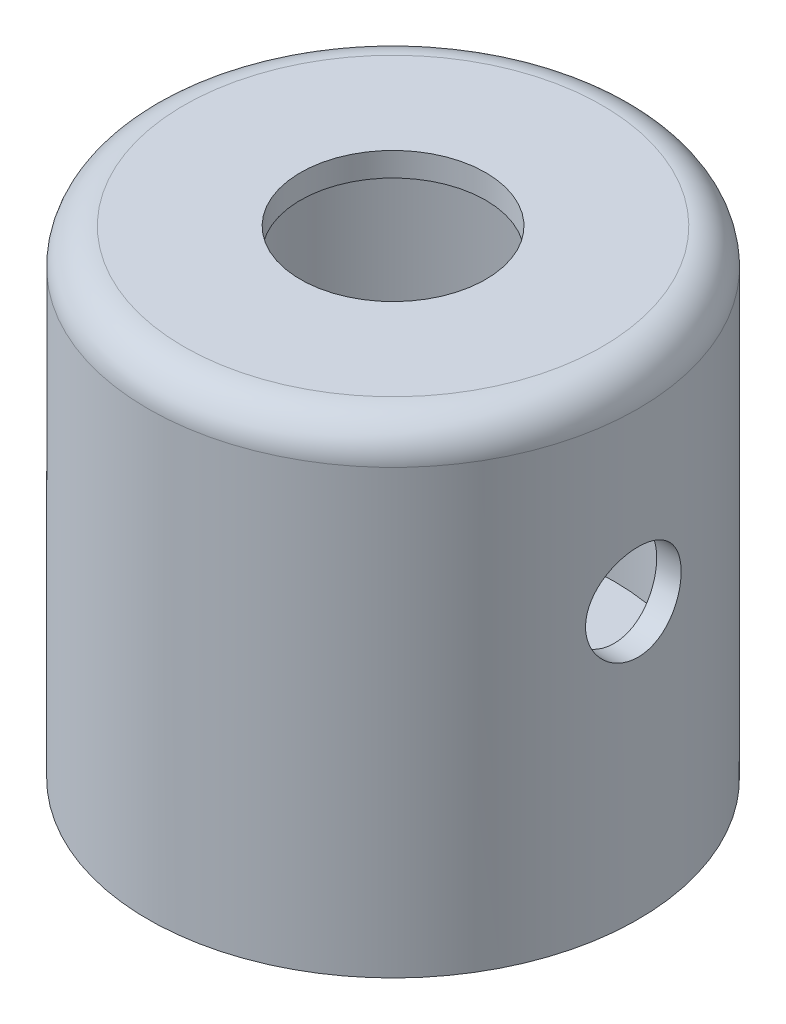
SolidWorks part; units mm, degrees
ref_plane "face" through (0, 0, 0) normal (0, 0, 1) x (1, 0, 0)
ref_plane "dessus" through (0, 0, 0) normal (0, 1, 0) x (1, 0, 0)
ref_plane "profil" through (0, 0, 0) normal (1, 0, 0) x (0, 0, -1)
sketch "Esquisse1" plane through (0, 0, 0) normal (0, 0, 1) x (1, 0, 0)
  line L0 (0, -16.6647) -> (0, 93.9607) construction
  line L1 (18.5, 0) -> (18.5, 3)
  line L2 (18.5, 3) -> (7.75, 3)
  line L3 (7.75, 5) -> (18.5, 5)
  line L4 (7.75, 5) -> (7.75, 3)
  line L5 (18.5, 5) -> (18.5, 38)
  line L6 (18.5, 0) -> (20.5, 0)
  line L7 (20.5, 0) -> (20.5, 40)
  line L8 (7.75, 38) -> (18.5, 38)
  line L9 (7.75, 40) -> (20.5, 40)
  line L10 (7.75, 38) -> (7.75, 40)
  dimension "D1" = 18.5
  dimension "D2" = 3
  dimension "D3" = 7.75
  dimension "D4" = 18.5
  dimension "D5" = 2
  dimension "D6" = 33
  dimension "D7" = 2
  dimension "D8" = 3
  dimension "D9" = 7.75
  dimension "D10" = 2
revolve "Base-Révolution" add sketch "Esquisse1" angle 360 about L0
fillet "Congé1" radius 3
fillet "Congé2" radius 1
sketch "Esquisse2" plane through (0, 0, 0) normal (0, 0, 1) x (1, 0, 0)
  line L0 (16.0333, 23) -> (23.0138, 23) construction
  line L1 (-18.5, 0) -> (18.5, 0) construction
  line L3 (12.9794, 27) -> (23.0138, 27)
  line L4 (12.9794, 27) -> (12.9794, 23)
  line L5 (12.9794, 23) -> (23.0138, 23)
  line L6 (23.0138, 27) -> (23.0138, 23)
  dimension "D1" = 23
  dimension "D2" = 4
revolve "Enlèvement de matière-Révolution1" cut sketch "Esquisse2" angle 360 about L0
